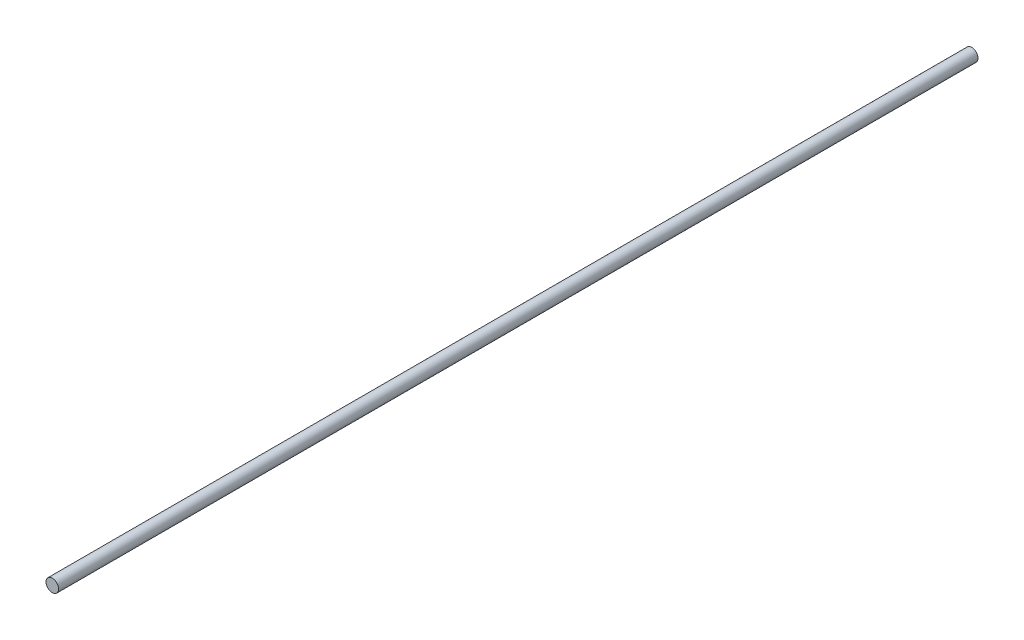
SolidWorks part; units mm, degrees
ref_plane "前视基准面" through (0, 0, 0) normal (0, 0, 1) x (1, 0, 0)
ref_plane "上视基准面" through (0, 0, 0) normal (0, 1, 0) x (1, 0, 0)
ref_plane "右视基准面" through (0, 0, 0) normal (1, 0, 0) x (0, 0, -1)
sketch "草图2" plane through (0, 0, 0) normal (0, 0, 1) x (1, 0, 0)
  circle A0 centre (0, 0) radius 10
  dimension "D1" = 20
extrude "凸台-拉伸1" add sketch "草图2" along normal mid plane 1460
